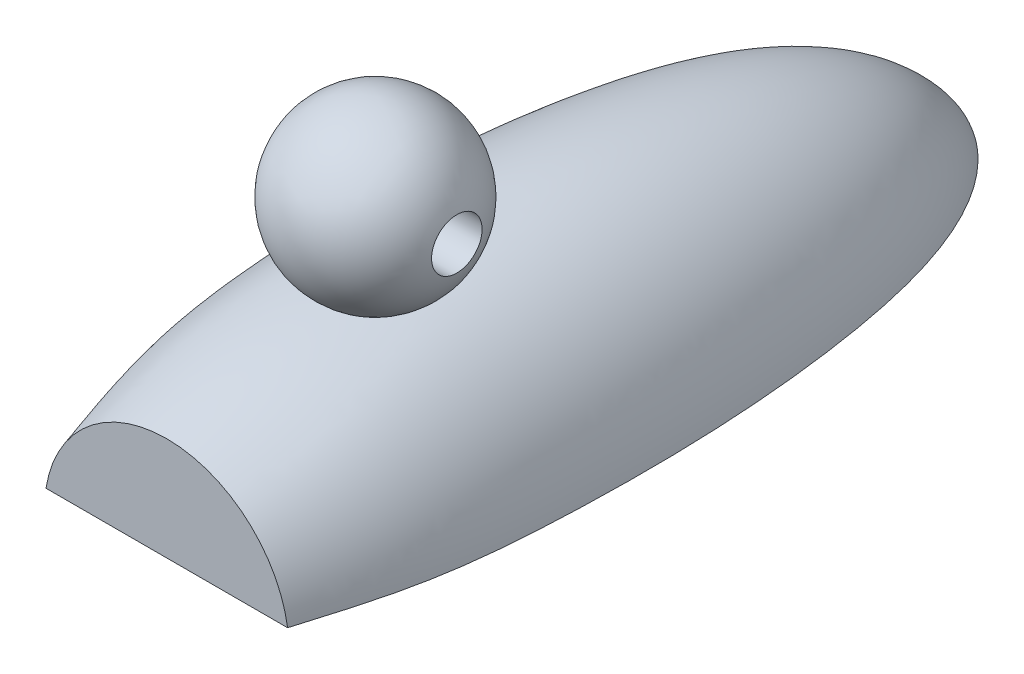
SolidWorks part; units mm, degrees
ref_plane "Plan de face" through (0, 0, 0) normal (0, 0, 1) x (1, 0, 0)
ref_plane "Plan de dessus" through (0, 0, 0) normal (0, 1, 0) x (1, 0, 0)
ref_plane "Plan de droite" through (0, 0, 0) normal (1, 0, 0) x (0, 0, -1)
sketch "Esquisse1" plane through (0, 0, 0) normal (0, 0, 1) x (1, 0, 0)
  line L1 (25.7876, 8) -> (-25.7876, 8)
  line L2 (36.8111, 0) -> (-51.7195, 0) construction
  arc A0 (25.7876, 8) -> (-25.7876, 8) centre (0, 0) ccw
  dimension "D1" = 54
  dimension "D2" = 16
revolve "Révolution1" add sketch "Esquisse1" angle 360 about L2
sketch "Esquisse2" plane through (0, 0, 0) normal (1, 0, 0) x (0, 0, -1)
  line L0 (-66, -72) -> (186, -72)
  line L1 (-66, -72) -> (-66, -33.301)
  spline_without_curve S0
  dimension "D1" = 252
  dimension "D2" = 66
  dimension "D3" = 72
revolve "Révolution2" add sketch "Esquisse2" angle 180 mid plane about L0
sketch "Esquisse3" plane through (0, 0, 0) normal (0, 0, 1) x (1, 0, 0)
  line L1 (-100, -66) -> (100, -66)
  line L2 (-100, -66) -> (-100, -76)
  line L3 (-100, -76) -> (100, -76)
  line L4 (100, -66) -> (100, -76)
  dimension "D1" = 66
  dimension "D2" = 100
  dimension "D3" = 100
  dimension "D4" = 10
extrude "Enlèv. mat.-Extru.1" cut sketch "Esquisse3" against normal through all and the other way through all
